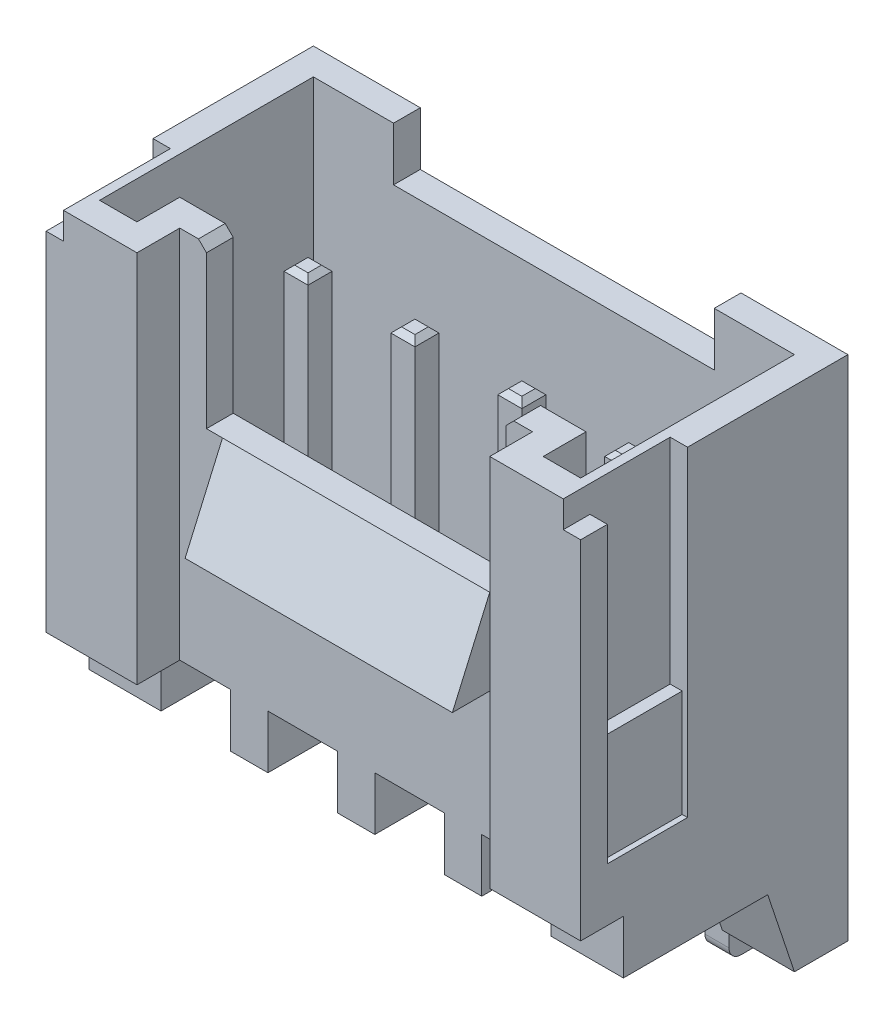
SolidWorks part; units mm, degrees
ref_plane "Plan de face" through (0, 0, 0) normal (0, 0, 1) x (1, 0, 0)
ref_plane "Plan de dessus" through (0, 0, 0) normal (0, 1, 0) x (1, 0, 0)
ref_plane "Plan de droite" through (0, 0, 0) normal (1, 0, 0) x (0, 0, -1)
sketch "Esquisse1" plane through (0, 0, 0) normal (0, 1, 0) x (1, 0, 0)
  line L1 (-5, 0) -> (5, 0)
  line L2 (-5, 0) -> (-5, 5)
  line L3 (-5, 5) -> (5, 5)
  line L4 (5, 0) -> (5, 5)
  dimension "D1" = 10
  dimension "D2" = 5
extrude "Boss.-Extru.1" add sketch "Esquisse1" along normal blind 8
sketch "Esquisse7" plane through (5, 0, 0) normal (1, 0, 0) x (0, 0, -1)
  line L1 (0, 0) -> (0.8, 0)
  line L2 (0, 0) -> (0, 1)
  line L3 (0, 1) -> (0.8, 1)
  line L4 (0.8, 0) -> (0.8, 1)
  dimension "D1" = 0.8
  dimension "D2" = 1
extrude "Enlèv. mat.-Extru.5" cut sketch "Esquisse7" against normal through all
ref_plane "Plan1" through (3, 0, 0) normal (1, 0, 0) x (0, 0, -1)
sketch "Esquisse8" plane through (3, 0, 0) normal (1, 0, 0) x (0, 0, -1)
  line L0 (0.8, 1) -> (1.1, 1)
  line L1 (1.1, 1) -> (1.9, 0.2)
  line L2 (1.9, 0.2) -> (3.9, 0.2)
  line L3 (3.9, 0.2) -> (4.7, 1)
  line L4 (4.7, 1) -> (5, 1)
  line L5 (5, 8) -> (5, 0) construction
  line L6 (5, 1) -> (5, 0)
  line L7 (5, 0) -> (0.8, 0)
  line L8 (0.8, 0) -> (0.8, 1)
  line L9 (0.8, 0) -> (0.8, 1) construction
  dimension "D1" = 0.2
  dimension "D2" = 0.3
  dimension "D3" = 45
extrude "Enlèv. mat.-Extru.6" cut sketch "Esquisse8" against normal mid plane 1.3
pattern_linear "Répétition linéaire3" count 4 spacing 2 along (-1, 0, 0) of "Enlèv. mat.-Extru.6"
sketch "Esquisse2" plane through (0, 8, 0) normal (0, 1, 0) x (1, 0, 0)
  line L0 (-5, 0) -> (5, 0) construction
  line L1 (-3.3, -0.8) -> (3.3, -0.8)
  line L2 (-3.3, -0.8) -> (-3.3, 0.8)
  line L3 (-3.3, 0.8) -> (3.3, 0.8)
  line L4 (3.3, -0.8) -> (3.3, 0.8)
  line L5 (-3.3, -0.8) -> (3.3, 0.8) construction
  line L6 (-3.3, 0.8) -> (3.3, -0.8) construction
  line L7 (5, 0) -> (5, 5) construction
  point P0 (0, 0)
  dimension "D1" = 0.8
  dimension "D2" = 1.7
extrude "Enlèv. mat.-Extru.1" cut sketch "Esquisse2" against normal through all
sketch "Esquisse4" plane through (0, 8, 0) normal (0, 1, 0) x (1, 0, 0)
  line L16 (-3.8, 1.3) -> (3.8, 1.3)
  line L17 (3.8, 1.3) -> (3.8, 0.5)
  line L18 (3.8, 0.5) -> (4.5, 0.5)
  line L19 (4.5, 0.5) -> (4.5, 4.5)
  line L20 (4.5, 4.5) -> (-4.5, 4.5)
  line L21 (-4.5, 4.5) -> (-4.5, 0.5)
  line L22 (-4.5, 0.5) -> (-3.8, 0.5)
  line L23 (-3.8, 0.5) -> (-3.8, 1.3)
  line L24 (-3.8, 1.3) -> (3.8, 1.3)
  line L25 (3.8, 1.3) -> (3.8, 0.5)
  line L26 (3.8, 0.5) -> (4.5, 0.5)
  line L27 (4.5, 0.5) -> (4.5, 4.5)
  line L28 (4.5, 4.5) -> (-4.5, 4.5)
  line L29 (-4.5, 4.5) -> (-4.5, 0.5)
  line L30 (-4.5, 0.5) -> (-3.8, 0.5)
  line L31 (-3.8, 0.5) -> (-3.8, 1.3)
  dimension "D1" = 0.5
extrude "Enlèv. mat.-Extru.2" cut sketch "Esquisse4" against normal blind 6.5
sketch "Esquisse5" plane through (0, 8, 0) normal (0, 1, 0) x (1, 0, 0)
  line L0 (4.5, 4.5) -> (-4.5, 4.5) construction
  line L1 (-3, 4) -> (3, 4)
  line L2 (-3, 4) -> (-3, 5)
  line L3 (-3, 5) -> (3, 5)
  line L4 (3, 4) -> (3, 5)
  line L5 (-3, 4) -> (3, 5) construction
  line L6 (-3, 5) -> (3, 4) construction
  line L7 (5, 5) -> (-5, 5) construction
  line L8 (5, 0) -> (5, 5) construction
  point P0 (0, 4.5)
  dimension "D1" = 2
extrude "Enlèv. mat.-Extru.3" cut sketch "Esquisse5" against normal blind 1
sketch "Esquisse6" plane through (0, 8, 0) normal (0, 1, 0) x (1, 0, 0)
  line L0 (3.3, 0.8) -> (-3.3, 0.8) construction
  line L1 (-2.8, 0.3) -> (2.8, 0.3)
  line L2 (-2.8, 0.3) -> (-2.8, 1.3)
  line L3 (-2.8, 1.3) -> (2.8, 1.3)
  line L4 (2.8, 0.3) -> (2.8, 1.3)
  line L5 (-2.8, 0.3) -> (2.8, 1.3) construction
  line L6 (-2.8, 1.3) -> (2.8, 0.3) construction
  line L7 (-3.8, 1.3) -> (3.8, 1.3) construction
  line L8 (5, 0) -> (5, 5) construction
  point P0 (0, 0.8)
  dimension "D1" = 2.2
extrude "Enlèv. mat.-Extru.4" cut sketch "Esquisse6" against normal blind 3
sketch "Esquisse11" plane through (0, 0, 0) normal (1, 0, 0) x (0, 0, -1)
  line L0 (0.8, 5) -> (0.1, 3.4)
  line L1 (0.8, 5) -> (0.8, 8) construction
  line L2 (1.3, 5) -> (0.8, 5) construction
  line L3 (0.1, 3.4) -> (0.8, 3.4)
  line L4 (0.8, 1) -> (0.8, 8) construction
  line L5 (0.8, 3.4) -> (0.8, 5)
  dimension "D1" = 0.7
  dimension "D2" = 1.6
extrude "Boss.-Extru.2" add sketch "Esquisse11" along normal mid plane 5
chamfer "Chanfrein1" distance 0.15 angle 45 2 edges at (2.8, 8, -1.05) (-2.8, 8, -1.05)
sketch "Esquisse16" plane through (3, 0, 0) normal (-1, 0, 0) x (0, 0, 1)
  line L0 (-2.9, 6.5) -> (-2.9, -0.0271)
  line L1 (-3.067, -0.2445) -> (-4.608, -0.6555)
  line L2 (-3.9, 0.2) -> (-1.9, 0.2) construction
  line L3 (-4.775, -0.8729) -> (-4.775, -2.5)
  line L4 (-5, 8) -> (-5, 0) construction
  line L6 (-5, 0) -> (-0.8, 0) construction
  arc A0 (-4.608, -0.6555) -> (-4.775, -0.8729) centre (-4.55, -0.8729) ccw
  arc A1 (-2.9, -0.0271) -> (-3.067, -0.2445) centre (-3.125, -0.0271) cw
  point P2 (-2.9, 0.2)
  point P13 (-4.775, -0.7)
  point P16 (-2.9, -0.2)
  dimension "D4" = 0.5
  dimension "D6" = 0.225
  dimension "D1" = 0.4
  dimension "D2" = 6.3
  dimension "D3" = 0.225
  dimension "D5" = 2.5
extrude "Extru.-Mince2" add sketch "Esquisse16" along normal mid plane 0.45 separate body thin
ref_plane "Plan2" through (0, -1.6, 0) normal (0, -1, 0) x (-1, 0, 0)
pattern_linear "Répétition linéaire4" count 4 spacing 2 along (-1, 0, 0)
sketch "Esquisse18" plane through (-5, 0, 0) normal (-1, 0, 0) x (0, 0, 1)
  line L0 (-5, 0) -> (-5, -1.5)
  line L1 (-5, -1.5) -> (-4, -1.5)
  line L2 (-4, -1.5) -> (-3.5, 0)
  line L3 (-5, 0) -> (-0.8, 0) construction
  line L4 (-3.5, 0) -> (-5, 0)
  dimension "D1" = 1.5
  dimension "D2" = 1.5
  dimension "D3" = 1
extrude "Boss.-Extru.4" add sketch "Esquisse18" against normal blind 1.35
chamfer "Chanfrein2" distance 0.1 angle 45 4 edges at (3, 6.5, -2.675) (2.775, 6.5, -2.9) (3, 6.5, -3.125) (3.225, 6.5, -2.9)
fillet "Congé1" radius 0.225 1 edges at (-3, -2.5, -4.55)
fillet "Congé2" radius 0.225 1 edges at (-1, -2.5, -4.55)
fillet "Congé3" radius 0.225 1 edges at (1, -2.5, -4.55)
fillet "Congé4" radius 0.225 1 edges at (3, -2.5, -4.55)
sketch "Esquisse19" plane through (-5, 0, 0) normal (-1, 0, 0) x (0, 0, 1)
  line L0 (-3.5, 0) -> (-0.8, 0) construction
  line L1 (-2, 8.4401) -> (-0.5, 8.4401)
  line L2 (-2, 8.4401) -> (-2, 2)
  line L3 (-2, 2) -> (-0.5, 2)
  line L4 (-0.5, 8.4401) -> (-0.5, 2)
  line L5 (0, 8) -> (0, 1) construction
  dimension "D1" = 2
  dimension "D2" = 0.5
  dimension "D3" = 1.5
extrude "Enlèv. mat.-Extru.7" cut sketch "Esquisse19" against normal blind 0.1
sketch "Esquisse20" plane through (-4.9, 0, 0) normal (-1, 0, 0) x (0, 0, 1)
  line L0 (-2, 8) -> (-2, 2) construction
  line L1 (-2, 4) -> (-0.5, 4)
  line L2 (-2, 4) -> (-2, 8.3888)
  line L3 (-2, 8.3888) -> (0.5607, 8.3888)
  line L4 (-0.5, 4) -> (-0.5, 7.5)
  line L5 (-0.5, 2) -> (-0.5, 8) construction
  line L6 (-2, 2) -> (-0.5, 2) construction
  line L7 (-0.5, 7.5) -> (0.5607, 7.5)
  line L8 (0.5607, 7.5) -> (0.5607, 8.3888)
  line L9 (-0.5, 8) -> (0, 8) construction
  dimension "D1" = 2
  dimension "D2" = 0.5
extrude "Enlèv. mat.-Extru.8" cut sketch "Esquisse20" against normal blind 0.225 and the other way blind 0.225
mirror "Symétrie5" about plane through (0, 0, 0) normal (1, 0, 0) of "Enlèv. mat.-Extru.7"
mirror "Symétrie6" about plane through (0, 0, 0) normal (1, 0, 0) of "Enlèv. mat.-Extru.8"
chamfer "Chanfrein3" distance 0.1 angle 45 4 edges at (-3, 6.5, -2.675) (-3.225, 6.5, -2.9) (-3, 6.5, -3.125) (-2.775, 6.5, -2.9)
chamfer "Chanfrein4" distance 0.1 angle 45 4 edges at (-1, 6.5, -2.675) (-1.225, 6.5, -2.9) (-1, 6.5, -3.125) (-0.775, 6.5, -2.9)
chamfer "Chanfrein5" distance 0.1 angle 45 4 edges at (1, 6.5, -2.675) (0.775, 6.5, -2.9) (1, 6.5, -3.125) (1.225, 6.5, -2.9)
mirror "Symétrie8" about plane through (0, 0, 0) normal (1, 0, 0) of "Boss.-Extru.4"
